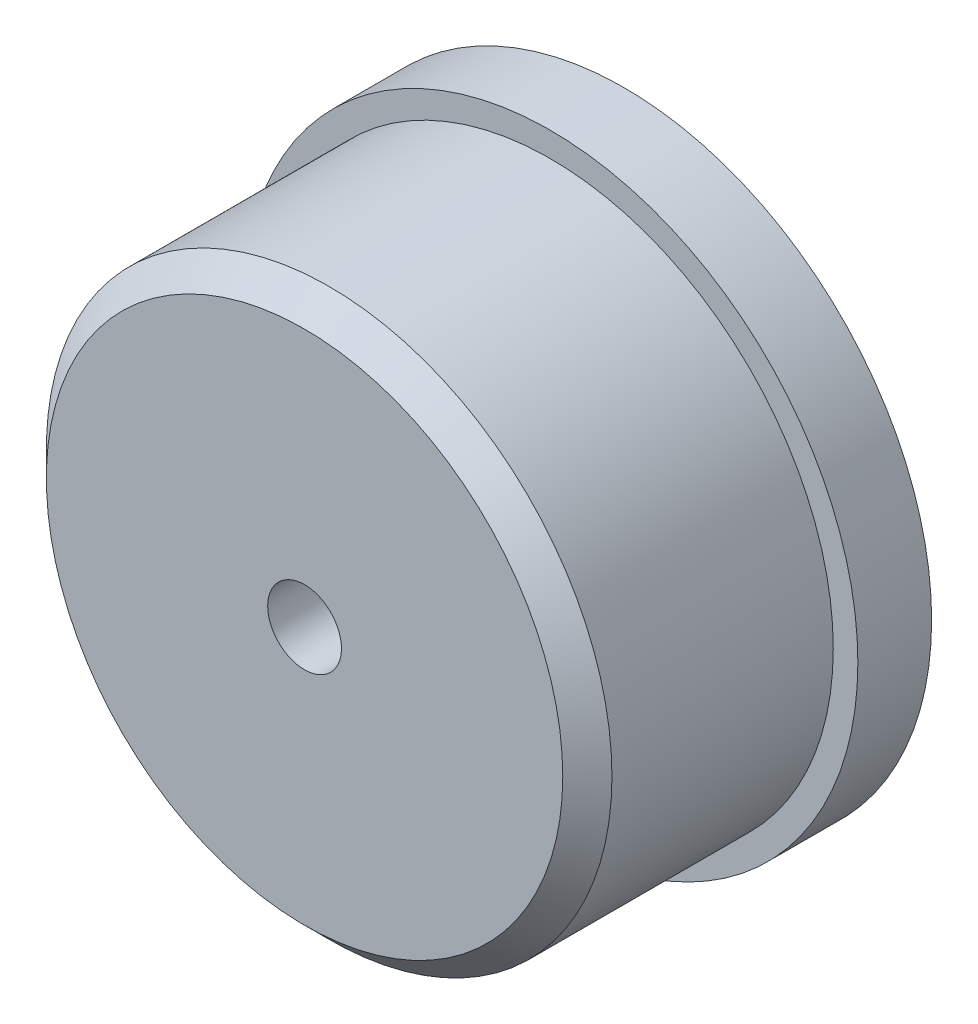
SolidWorks part; units mm, degrees
ref_plane "Plan de face" through (0, 0, 0) normal (0, 0, 1) x (1, 0, 0)
ref_plane "Plan de dessus" through (0, 0, 0) normal (0, 1, 0) x (1, 0, 0)
ref_plane "Plan de droite" through (0, 0, 0) normal (1, 0, 0) x (0, 0, -1)
sketch "Esquisse1" plane through (0, 0, 0) normal (0, 0, 1) x (1, 0, 0)
  circle A0 centre (0, 0) radius 12.5
  dimension "D1" = 25
extrude "Extrusion1" add sketch "Esquisse1" along normal blind 3
sketch "Esquisse2" plane through (0, 0, 3) normal (0, 0, 1) x (1, 0, 0)
  circle A0 centre (0, 0) radius 11.5
  dimension "D1" = 23
extrude "Extrusion2" add sketch "Esquisse2" along normal blind 10
chamfer "Chanfrein1" distance 1 angle 45 1 edges at (11.5, 0, 13)
hole_wizard "Trou taraudé M41" positions "Esquisse4" profile "Esquisse3" tap size "M4" standard "ISO"
sketch "Esquisse4" plane through (0, 0, 0) normal (0, 0, -1) x (-1, 0, 0)
  point P0 (0, 0)
sketch "Esquisse3" plane through (0, 0, 0) normal (1, 0, 0) x (0, 1, 0)
  line L0 (0, 0) -> (0, 13)
  line L1 (0, 13) -> (1.5, 13)
  line L2 (1.5, 13) -> (1.5, 0)
  line L5 (1.5, 0) -> (0, 0)
  line L11 (0, -6.35) -> (0, 107.95) construction
  dimension "Diamètre du trou pour taraudage jusqu'au prochain" = 3
  dimension "Profondeur du trou pour taraudage jusqu'au prochain" = 13
